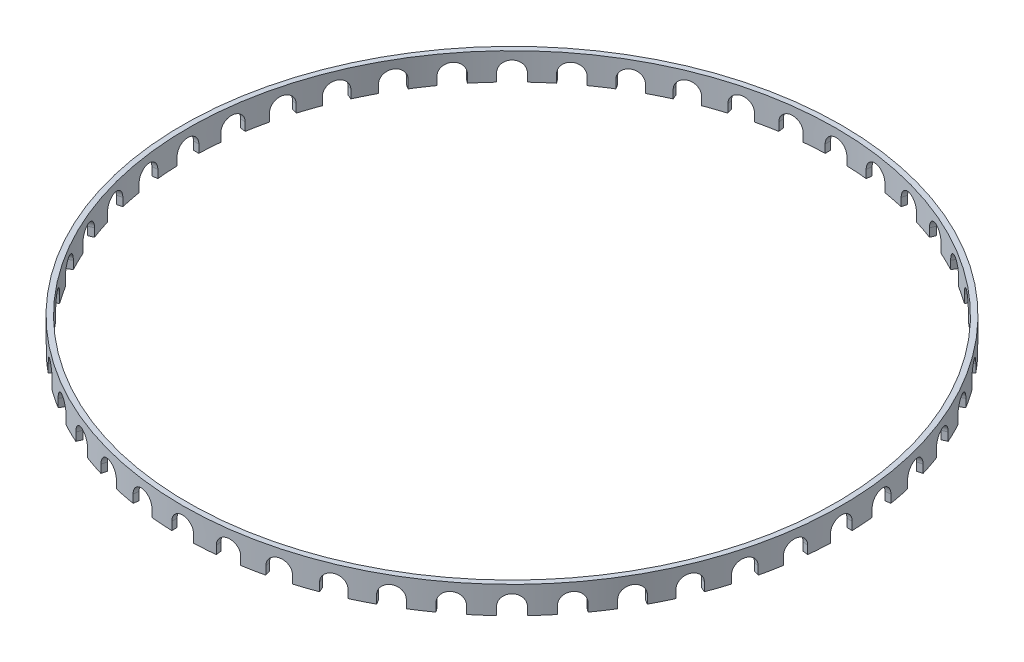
SolidWorks part; units mm, degrees
ref_plane "Front" through (0, 0, 0) normal (0, 0, 1) x (1, 0, 0)
ref_plane "Top" through (0, 0, 0) normal (0, 1, 0) x (1, 0, 0)
ref_plane "Right" through (0, 0, 0) normal (1, 0, 0) x (0, 0, -1)
sketch "Sketch1" plane through (0, 0, 0) normal (0, 0, 1) x (1, 0, 0)
  line L0 (0, 0) -> (0, 39.5911) construction
  line L1 (0, 0) -> (-60.6234, 0) construction
  line L2 (-60.6234, -1.524) -> (-60.6234, 3.556)
  line L3 (-61.614, 3.556) -> (-61.614, -1.524)
  line L4 (-61.614, 3.556) -> (-60.6234, 3.556)
  line L5 (-61.614, -1.524) -> (-60.6234, -1.524)
  dimension "I.D." = 121.2469
  dimension "D2" = 3.556
  dimension "D3" = 5.08
  dimension "D4" = 0.9906
revolve "Base-Revolve" add sketch "Sketch1" angle 360 about L0
sketch "Sketch2" plane through (0, 0, 0) normal (1, 0, 0) x (0, 0, -1)
  line L0 (0, 0) -> (0, -1.524) construction
  line L1 (-61.614, -1.524) -> (61.614, -1.524) construction
  line L2 (-2.032, -1.524) -> (2.032, -1.524)
  line L3 (2.032, -1.524) -> (2.032, 0)
  line L4 (-2.032, -1.524) -> (-2.032, 0)
  arc A0 (2.032, 0) -> (-2.032, 0) centre (0, 0) ccw
  dimension "D1" = 4.064
  dimension "D3" = 4.064
extrude "Cut-Extrude Pocket" cut sketch "Sketch2" against normal up to surface (61.5805 mm away)
pattern_circular "CirPattern Pocket" count 48 every 7.5 about axis through (0, 0, 0) along (0, 1, 0) of "Cut-Extrude Pocket"
